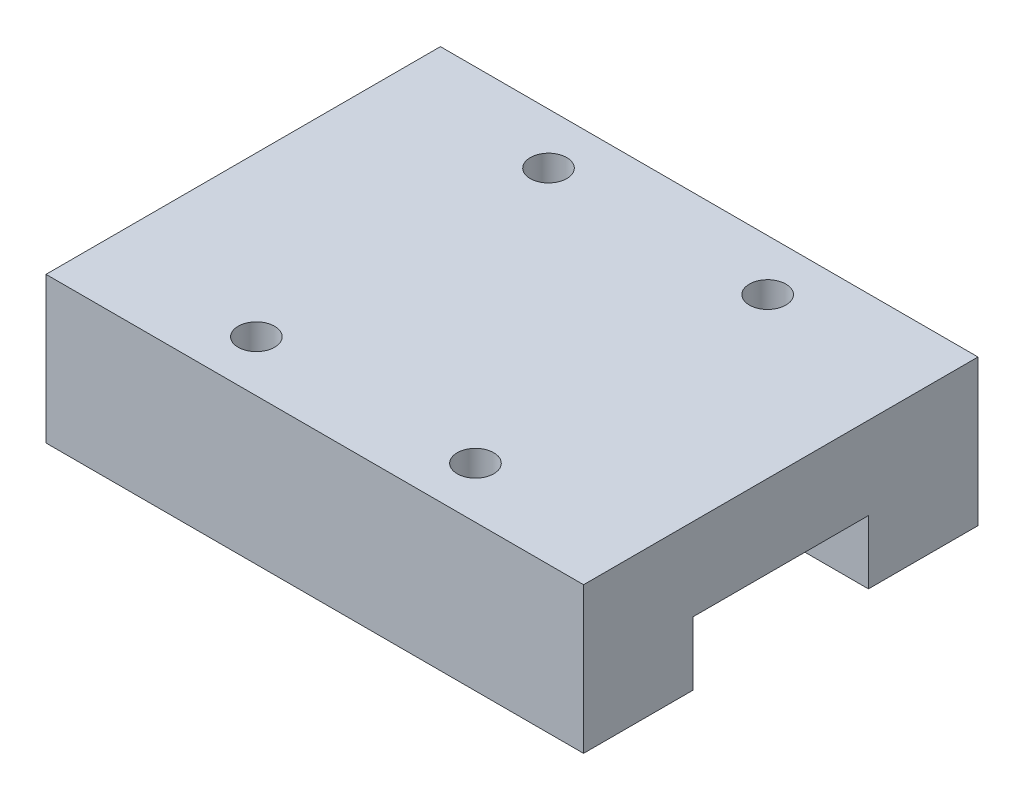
SolidWorks part; units mm, degrees
ref_plane "前视基准面" through (0, 0, 0) normal (0, 0, 1) x (1, 0, 0)
ref_plane "上视基准面" through (0, 0, 0) normal (0, 1, 0) x (1, 0, 0)
ref_plane "右视基准面" through (0, 0, 0) normal (1, 0, 0) x (0, 0, -1)
sketch "草图1" plane through (0, 0, 0) normal (0, 0, 1) x (1, 0, 0)
  line L0 (0, 10) -> (36.8, 10)
  line L1 (0, 0) -> (36.8, 0)
  line L2 (0, 0) -> (0, 10)
  line L3 (36.8, 0) -> (36.8, 10)
extrude "凸台-拉伸1" add sketch "草图1" along normal blind 27
sketch "草图2" plane through (0, 10, 0) normal (0, 1, 0) x (1, 0, 0)
  circle A0 centre (10.9, -3.5) radius 1.25
  circle A1 centre (10.9, -23.5) radius 1.25
  circle A2 centre (25.9, -23.5) radius 1.25
  circle A3 centre (25.9, -3.5) radius 1.25
extrude "切除-拉伸1" cut sketch "草图2" against normal blind 27
sketch "草图3" plane through (36.8, 0, 0) normal (1, 0, 0) x (0, 0, -1)
  line L0 (-27, 0) -> (0, 0) construction
  line L1 (-19.5, -2.8705) -> (-7.5, -2.8705)
  line L2 (-19.5, -2.8705) -> (-19.5, 4.35)
  line L3 (-19.5, 4.35) -> (-7.5, 4.35)
  line L4 (-7.5, -2.8705) -> (-7.5, 4.35)
  line L5 (-13.5, 10) -> (-13.5, 0) construction
  line L6 (-27, 10) -> (0, 10) construction
  dimension "D1" = 12
  dimension "D2" = 4.35
extrude "切除-拉伸2" cut sketch "草图3" against normal through all
